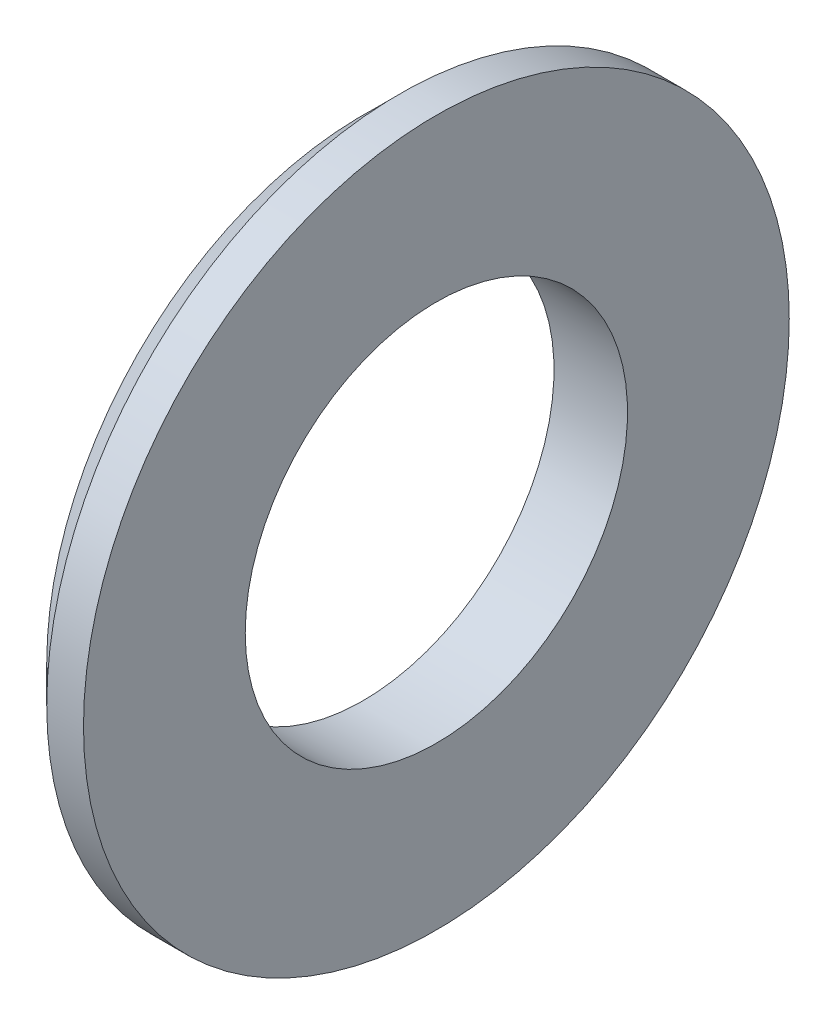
SolidWorks part; units mm, degrees
ref_plane "Plane1" through (0, 0, 0) normal (0, 0, 1) x (1, 0, 0)
ref_plane "Plane2" through (0, 0, 0) normal (0, 1, 0) x (1, 0, 0)
ref_plane "Plane3" through (0, 0, 0) normal (1, 0, 0) x (0, 0, -1)
sketch "Sketch1" plane through (0, 0, 0) normal (0, 0, 1) x (1, 0, 0)
  line L0 (-34.925, 0) -> (9.525, 0) construction
  line L1 (0, 6.5) -> (0, 12)
  line L2 (0, 12) -> (-1.25, 12)
  line L3 (-2.5, 10.75) -> (-2.5, 6.5)
  line L4 (-2.5, 6.5) -> (0, 6.5)
  line L5 (-2.5, 10.75) -> (-1.25, 12)
  dimension "D2" = 45
  dimension "D3" = 1.25
  dimension "Thickness" = 2.5
  dimension "Inside_dia" = 13
  dimension "Outside_dia" = 24
revolve "Base-Revolve" add sketch "Sketch1" angle 360 about L0
equation "\"D3@Sketch1\" = \"Thickness@Sketch1\" * .5"
